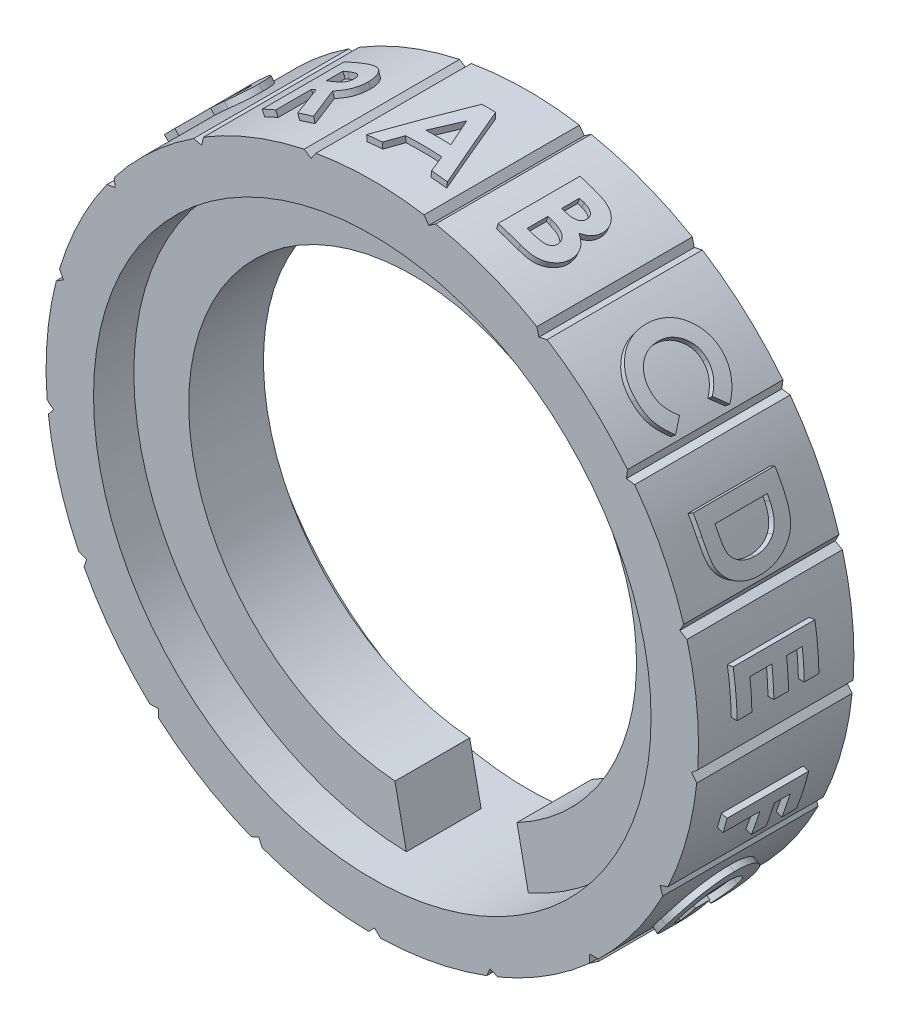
SolidWorks part; units mm, degrees
ref_plane "Front Plane" through (0, 0, 0) normal (0, 0, 1) x (1, 0, 0)
ref_plane "Top Plane" through (0, 0, 0) normal (0, 1, 0) x (1, 0, 0)
ref_plane "Right Plane" through (0, 0, 0) normal (1, 0, 0) x (0, 0, -1)
sketch "Sketch1" plane through (0, 0, 0) normal (0, 0, 1) x (1, 0, 0)
  circle A0 centre (0, 0) radius 13.97
  circle A1 centre (0, 0) radius 11.938
  dimension "D1" = 27.94
  dimension "D2" = 23.876
extrude "Boss-Extrude1" add sketch "Sketch1" along normal mid plane 6.6548
sketch "Sketch2" plane through (0, 0, 0) normal (0, 0, 1) x (1, 0, 0)
  line L0 (0, 0) -> (0, 7.4928) construction
  line L1 (-2.667, 7.4928) -> (2.667, 7.4928)
  line L3 (-2.667, 7.4928) -> (2.667, 7.4928)
  line L4 (-2.667, 7.4928) -> (-2.667, 12.4168)
  line L5 (-2.667, 12.4168) -> (2.667, 12.4168)
  line L6 (2.667, 7.4928) -> (2.667, 12.4168)
  circle A0 centre (0, 0) radius 9.5885
  circle A1 centre (0, 0) radius 12.7
  dimension "D1" = 19.177
  dimension "D4" = 25.4
  dimension "D2" = 5.334
  dimension "D3" = 4.924
extrude "Boss-Extrude2" add sketch "Sketch2" along normal mid plane 3.2004 contours L4 A1 L6 A0 | A0 L6 L5 L4
sketch "Sketch3" plane through (0, 0, 0) normal (0, 1, 0) x (1, 0, 0)
  text T0 "<b>A   B    C   D   E     F   G   H    I     J     K    L   M  N   O   P    R </b>" font "Century Gothic" height 3.5
wrap "Wrap1" sketch "Sketch3" wrap type emboss source sketch "Sketch3" thickness 0.254 parameters "D1"=0.254
sketch "Sketch4" plane through (0, 0, 0) normal (0, 0, 1) x (1, 0, 0)
  line L0 (0, 0) -> (-2.667, 13.7131) construction
  line L1 (-2.667, 13.7131) -> (2.667, 13.7131) construction
  line L2 (2.667, 13.7131) -> (0, 0) construction
  line L3 (-2.6185, 13.4637) -> (-2.9159, 13.6623)
  line L4 (-2.6185, 13.4637) -> (-2.4172, 13.7593)
  circle A0 centre (0, 0) radius 13.97 construction
  circle A1 centre (0, 0) radius 13.97
  dimension "D1" = 0.508
  dimension "D2" = 0.254
extrude "Cut-Extrude1" cut sketch "Sketch4" against normal mid plane 42.2148 contours L4 A1 L3
pattern_circular "CirPattern1" count 17 over 360 about axis through (0, 0, 0) along (0, 0, 1) of "Cut-Extrude1"
sketch "Sketch5" plane through (0, 0, 0) normal (0, 0, 1) x (1, 0, 0)
  line L0 (-2.6122, -0.5376) -> (2.6122, 0.5376)
  line L1 (2.6122, 0.5376) -> (4.958, -10.8598)
  line L2 (0, 0) -> (0, 15.0728) construction
  line L3 (-2.6122, -0.5376) -> (-0.2665, -11.935)
  line L4 (0.1, -13.7156) -> (5.0479, -12.7533)
  line L5 (2.5739, -13.2345) -> (0, 0) construction
  circle A0 centre (0, 0) radius 11.938
  circle A1 centre (0, 0) radius 11.938 construction
  dimension "D2" = 5.334
  dimension "D1" = 5.334
  dimension "D3" = 11.6363
extrude "Cut-Extrude2" cut sketch "Sketch5" against normal mid plane 17.78 contours L3 A0 L1 L0
